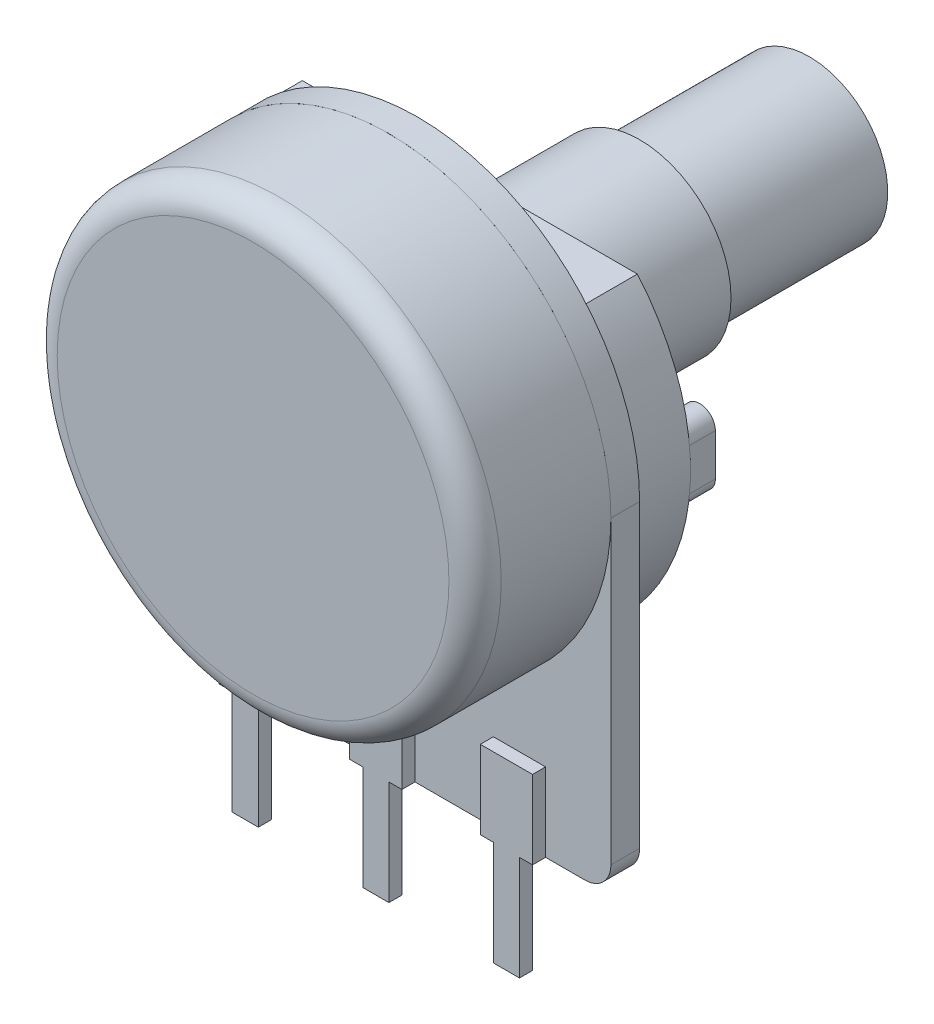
SolidWorks part; units mm, degrees
ref_plane "Спереди" through (0, 0, 0) normal (0, 0, 1) x (1, 0, 0)
ref_plane "Сверху" through (0, 0, 0) normal (0, 1, 0) x (1, 0, 0)
ref_plane "Справа" through (0, 0, 0) normal (1, 0, 0) x (0, 0, -1)
sketch "Эскиз1" plane through (0, 0, 0) normal (0, 0, 1) x (1, 0, 0)
  circle A0 centre (0, 0) radius 8.5
  dimension "D1" = 17
extrude "Вытянуть1" add sketch "Эскиз1" along normal blind 5.2
fillet "Скругление1" radius 1 1 edges at (8.5, 0, 5.2)
sketch "Эскиз6" plane through (0, 0, 0) normal (0, 0, -1) x (-1, 0, 0)
  line L0 (-8.5, 0) -> (-8.5, -12.5)
  line L1 (-8.5, -12.5) -> (8.5, -12.5)
  line L2 (8.5, -12.5) -> (8.5, 0)
  circle A1 centre (0, 0) radius 8.5
  arc A2 (8.5, 0) -> (-8.5, 0) centre (0, 0) ccw
  dimension "D2" = 12.5
  dimension "D1" = 0
extrude "Вытянуть8" add sketch "Эскиз6" along normal blind 1.1 separate body
fillet "Скругление2" radius 1 2 edges at (-8.5, -12.5, -0.55) (8.5, -12.5, -0.55)
sketch "Эскиз2" plane through (0, 0, -1.1) normal (0, 0, -1) x (-1, 0, 0)
  line L1 (6.4143, -5.5) -> (-6.415, -5.5)
  line L5 (-6.415, 5.5) -> (6.4143, 5.5)
  arc A0 (-6.415, 5.5) -> (-6.415, -5.5) centre (0, 0) ccw
  arc A1 (6.4143, 5.5) -> (6.4143, -5.5) centre (0, 0) cw
extrude "Вытянуть2" add sketch "Эскиз2" along normal blind 2
sketch "Эскиз3" plane through (0, 0, -1.1) normal (0, 0, -1) x (-1, 0, 0)
  circle A0 centre (0, 0) radius 3
  dimension "D1" = 6
extrude "Вытянуть7" add sketch "Эскиз3" along normal blind 15
sketch "Эскиз7" plane through (0, 0, 0) normal (0, 0, 1) x (1, 0, 0)
  line L0 (0, 0) -> (0, -12.5) construction
  line L1 (7.5, -12.5) -> (-7.5, -12.5) construction
  line L2 (-1, -9.5) -> (-1, -12.5)
  line L3 (-1, -12.5) -> (-0.5, -12.5)
  line L4 (-0.5, -12.5) -> (-0.5, -16.5)
  line L5 (0.5, -12.5) -> (0.5, -16.5)
  line L6 (1, -12.5) -> (0.5, -12.5)
  line L7 (1, -9.5) -> (1, -12.5)
  line L8 (-1, -9.5) -> (1, -9.5)
  line L9 (-0.5, -16.5) -> (0.5, -16.5)
  line L10 (-5, -7.2006) -> (-5, -12.5) construction
  line L11 (-6, -12.5) -> (-5.5, -12.5)
  line L12 (-6, -9.5) -> (-4, -9.5)
  line L13 (-4, -9.5) -> (-4, -12.5)
  line L14 (-6, -9.5) -> (-6, -12.5)
  line L15 (-4.5, -12.5) -> (-4.5, -16.5)
  line L16 (-5.5, -16.5) -> (-4.5, -16.5)
  line L17 (-5.5, -12.5) -> (-5.5, -16.5)
  line L18 (-4, -12.5) -> (-4.5, -12.5)
  line L19 (4, -12.5) -> (4.5, -12.5)
  line L20 (5.5, -12.5) -> (5.5, -16.5)
  line L21 (5.5, -16.5) -> (4.5, -16.5)
  line L22 (4.5, -12.5) -> (4.5, -16.5)
  line L23 (6, -9.5) -> (6, -12.5)
  line L24 (4, -9.5) -> (4, -12.5)
  line L25 (6, -9.5) -> (4, -9.5)
  line L26 (6, -12.5) -> (5.5, -12.5)
  dimension "D1" = 1
  dimension "D2" = 2
  dimension "D3" = 4
  dimension "D4" = 3
  dimension "D5" = 5
extrude "Вытянуть9" add sketch "Эскиз7" along normal blind 0.5 separate body
ref_plane "Плоскость1" through (-4.5, -16.5, 0) normal (0, 0, -1) x (-1, 0, 0)
sketch "Sketch1" plane through (0, 0, -3.1) normal (0, 0, -1) x (-1, 0, 0)
  line L2 (-8.4, 0.8) -> (-8.4, -0.8)
  line L4 (-7.2, 0.8) -> (-7.2, -0.8)
  arc A0 (-7.2, 0.8) -> (-8.4, 0.8) centre (-7.8, 0.8) ccw
  arc A1 (-8.4, -0.8) -> (-7.2, -0.8) centre (-7.8, -0.8) ccw
extrude "Boss-Extrude1" add sketch "Sketch1" along normal blind 1
sketch "Sketch2" plane through (0, 0, -3.1) normal (0, 0, -1) x (-1, 0, 0)
  circle A0 centre (0, 0) radius 3.5
extrude "Boss-Extrude2" add sketch "Sketch2" along normal blind 6.5
